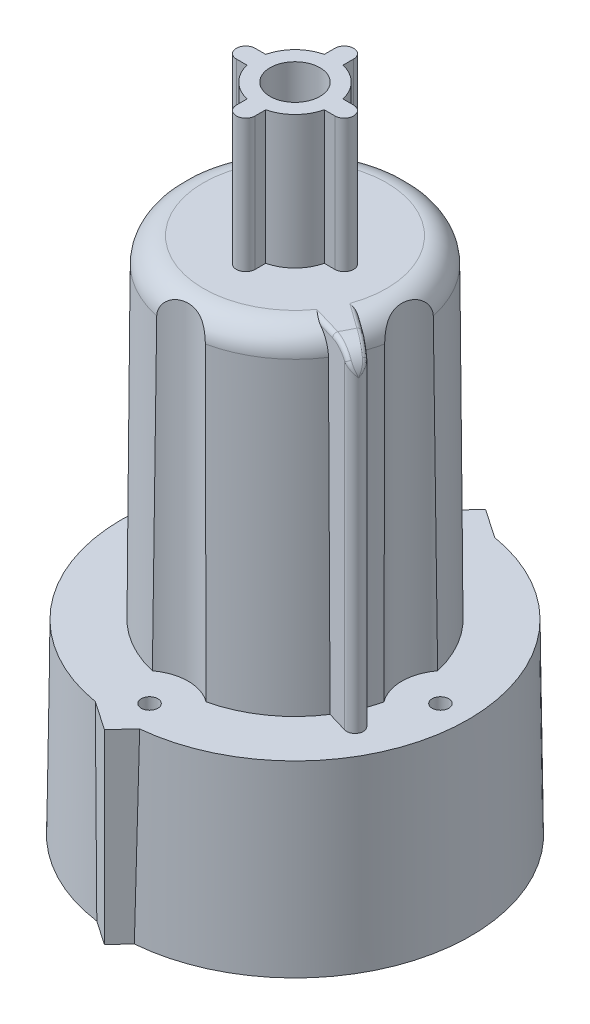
SolidWorks part; units mm, degrees
ref_plane "Plane1" through (0, 0, 0) normal (0, 0, 1) x (1, 0, 0)
ref_plane "Plane2" through (0, 0, 0) normal (0, 1, 0) x (1, 0, 0)
ref_plane "Plane3" through (0, 0, 0) normal (1, 0, 0) x (0, 0, -1)
imported_body "Imported1"
sketch "Sketch1" plane through (0, -2.2416, 0) normal (0, -1, 0) x (1, 0, 0)
  line L0 (-9.0817, -38.9654) -> (7.8436, 46.865) construction
  circle A1 centre (0, 0) radius 2.135
  circle A2 centre (0, 0) radius 2.135
  dimension "D1" = 0
extrude "Cut-Extrude1" cut sketch "Sketch1" against normal up to surface (48.6 mm away)
